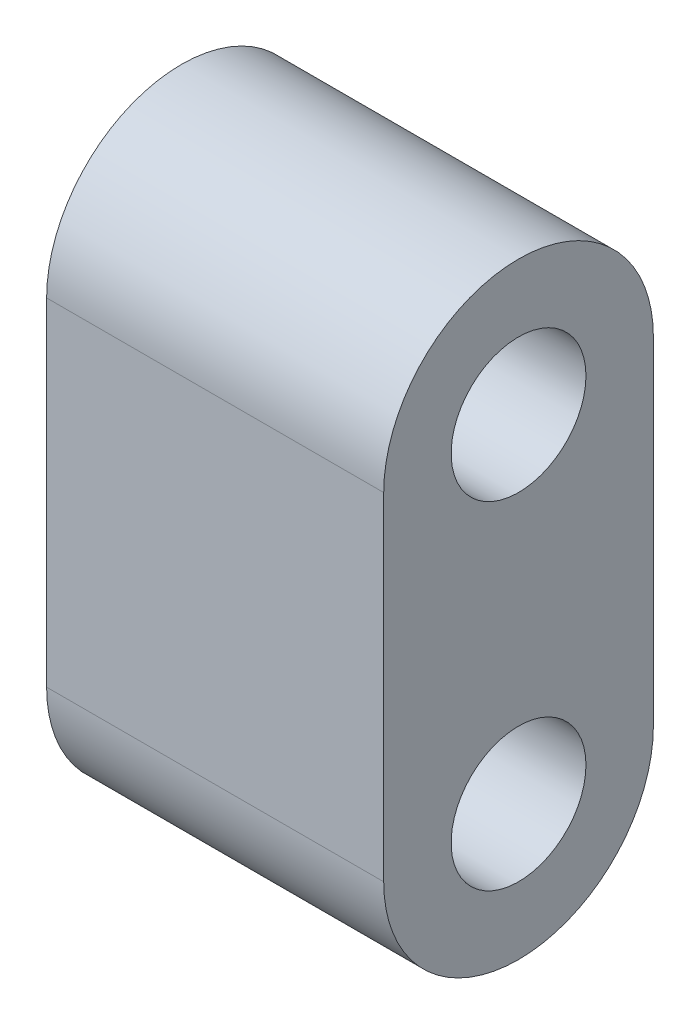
SolidWorks part; units mm, degrees
ref_plane "Front Plane" through (0, 0, 0) normal (0, 0, 1) x (1, 0, 0)
ref_plane "Top Plane" through (0, 0, 0) normal (0, 1, 0) x (1, 0, 0)
ref_plane "Right Plane" through (0, 0, 0) normal (1, 0, 0) x (0, 0, -1)
sketch "Sketch1" plane through (0, 0, 0) normal (1, 0, 0) x (0, 0, -1)
  line L0 (0, 0) -> (0, 6.5747) construction
  line L1 (4, 10) -> (4, 0)
  line L2 (-4, 10) -> (-4, 0)
  circle A0 centre (0, 0) radius 2
  circle A1 centre (0, 10) radius 2
  arc A2 (4, 10) -> (-4, 10) centre (0, 10) ccw
  arc A3 (4, 0) -> (-4, 0) centre (0, 0) cw
  dimension "D1" = 4
  dimension "D2" = 4
  dimension "D5" = 4
  dimension "D3" = 10
  dimension "D4" = 8
extrude "Boss-Extrude1" add sketch "Sketch1" along normal mid plane 10
